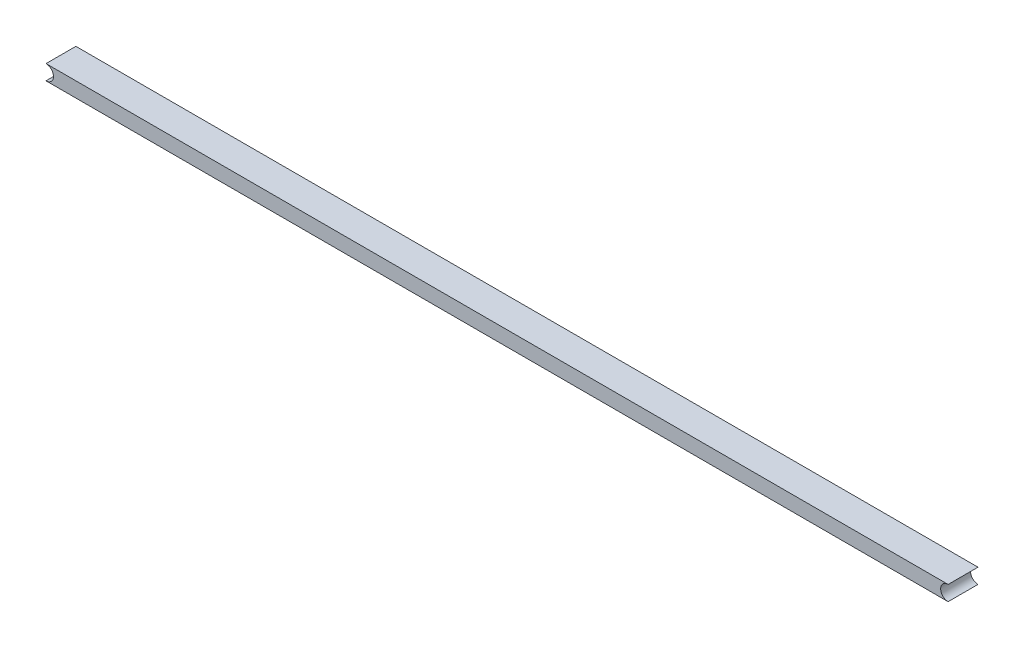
SolidWorks part; units mm, degrees
ref_plane "Plan1" through (0, 0, 0) normal (0, 0, 1) x (1, 0, 0)
ref_plane "Plan2" through (0, 0, 0) normal (0, 1, 0) x (1, 0, 0)
ref_plane "Plan3" through (0, 0, 0) normal (1, 0, 0) x (0, 0, -1)
sketch "Esquisse1" plane through (0, 0, 0) normal (1, 0, 0) x (0, 0, -1)
  line L1 (-10, 0) -> (10, 0)
  line L2 (-10, 0) -> (-10, -10)
  line L3 (-10, -10) -> (10, -10)
  line L4 (10, 0) -> (10, -10)
  dimension "D1" = 10
  dimension "D2" = 20
  dimension "D4" = 10
extrude "Base-Extrusion" add sketch "Esquisse1" along normal mid plane 604
sketch "Esquisse3" plane through (0, 0, 10) normal (0, 0, 1) x (1, 0, 0)
  line L0 (-302, 0) -> (-302, -10) construction
  circle A0 centre (-302, -5) radius 5
  dimension "D2" = 10
extrude "Enlèv. mat.-Extru.2" cut sketch "Esquisse3" against normal through all
sketch "Esquisse4" plane through (0, 0, 10) normal (0, 0, 1) x (1, 0, 0)
  line L0 (302, 0) -> (302, -10) construction
  circle A0 centre (302, -5) radius 5
  dimension "D1" = 10
extrude "Enlèv. mat.-Extru.3" cut sketch "Esquisse4" against normal through all
